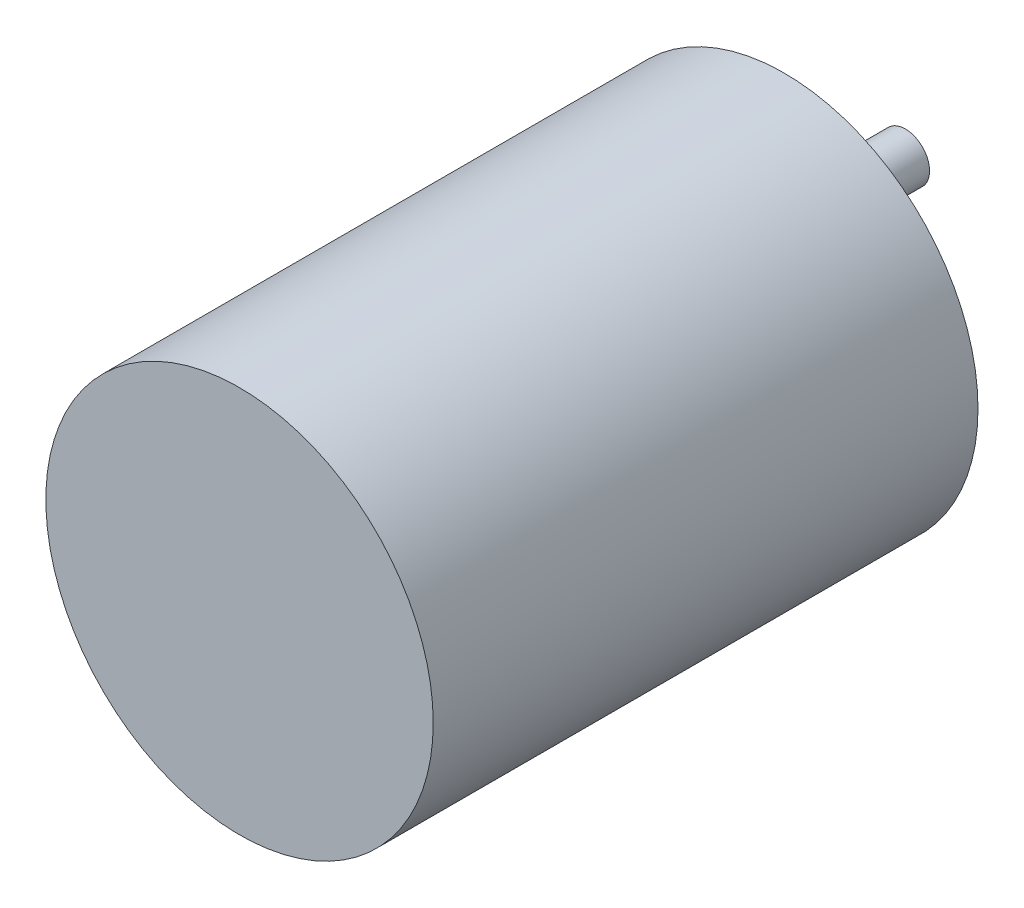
SolidWorks part; units mm, degrees
ref_plane "Спереди" through (0, 0, 0) normal (0, 0, 1) x (1, 0, 0)
ref_plane "Сверху" through (0, 0, 0) normal (0, 1, 0) x (1, 0, 0)
ref_plane "Справа" through (0, 0, 0) normal (1, 0, 0) x (0, 0, -1)
sketch "Эскиз1" plane through (0, 0, 0) normal (0, 0, 1) x (1, 0, 0)
  circle A0 centre (0, 0) radius 4.064
extrude "Бобышка-Вытянуть1" add sketch "Эскиз1" along normal blind 11.43
sketch "Эскиз2" plane through (0, 0, 0) normal (0, 0, -1) x (-1, 0, 0)
  circle A0 centre (0, 1.27) radius 0.508
  circle A1 centre (0, -1.27) radius 0.508
extrude "Бобышка-Вытянуть2" add sketch "Эскиз2" along normal blind 2.54
